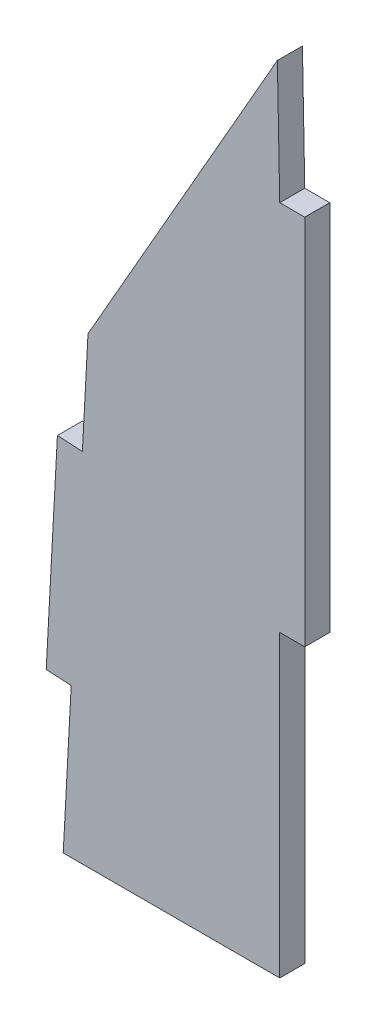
SolidWorks part; units mm, degrees
ref_plane "Front Plane" through (0, 0, 0) normal (0, 0, 1) x (1, 0, 0)
ref_plane "Top Plane" through (0, 0, 0) normal (0, 1, 0) x (1, 0, 0)
ref_plane "Right Plane" through (0, 0, 0) normal (1, 0, 0) x (0, 0, -1)
sketch "Sketch1" plane through (0, 0, 0) normal (0, 0, 1) x (1, 0, 0)
  line L0 (0, 38.77) -> (1.524, 38.77)
  line L1 (1.524, 38.77) -> (1.524, 16.1111)
  line L2 (1.524, 16.1111) -> (0, 16.1111)
  line L3 (0, 16.1111) -> (0, -2.1128)
  line L4 (0, -2.1128) -> (-13.1831, -2.1128)
  line L5 (0, 38.77) -> (-0.1427, 46.1991)
  line L6 (-0.1427, 40.5783) -> (-0.1427, 51.8199) construction
  line L7 (-0.1427, 46.1991) -> (-11.6734, 26.0272)
  line L9 (-12.6963, 6.9615) -> (-13.1831, -2.1128)
  line L10 (-11.6734, 26.0272) -> (-12.0159, 19.6433)
  line L12 (-12.0159, 19.6433) -> (-13.5377, 19.7249)
  line L13 (-12.6963, 6.9615) -> (-14.2181, 7.0432)
  line L15 (-13.5377, 19.7249) -> (-14.2181, 7.0432)
extrude "Boss-Extrude1" add sketch "Sketch1" along normal blind 1.524
